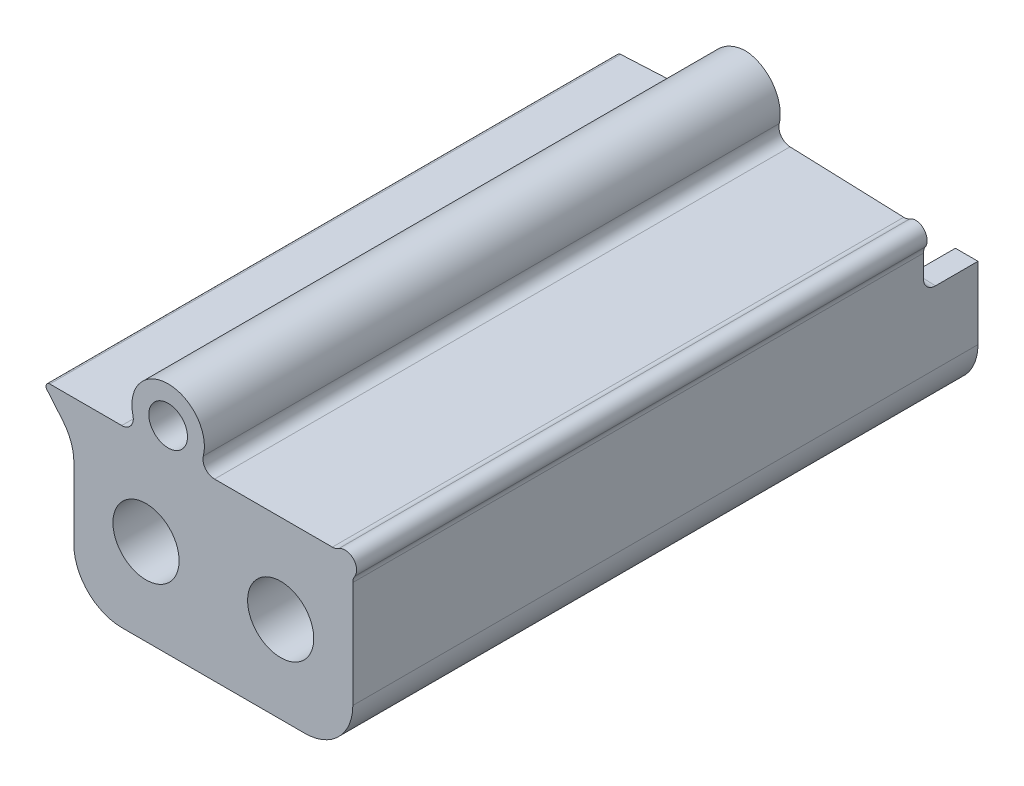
SolidWorks part; units mm, degrees
other "<24051_Punch[Mounted in the strip]>-<Cut-Extrude2>"
ref_plane "Front" through (0, 0, 0) normal (0, 0, 1) x (1, 0, 0)
ref_plane "Top" through (0, 0, 0) normal (0, 1, 0) x (1, 0, 0)
ref_plane "Right" through (0, 0, 0) normal (1, 0, 0) x (0, 0, -1)
inserted part "24051_Punch[Mounted in the strip]1"
hole_wizard "Hole1" positions "Point_Sketch" profile "Profil_Sketch" counterbore size "1/4" standard "ANSI Inch"
sketch "Point_Sketch" plane through (-72.3479, -94.696, -10.5918) normal (0, 0, 1) x (-1, 0, 0)
  point P0 (12.2341, -1.605)
  point P2 (-5.5459, -1.605)
sketch "Profil_Sketch" plane through (-84.582, -93.091, -10.5918) normal (1, 0, 0) x (0, 1, 0)
  line L0 (0, 0) -> (0, 82.55)
  line L1 (0, 82.55) -> (4.3688, 82.55)
  line L3 (4.3688, 82.55) -> (4.3688, 26.924)
  line L4 (4.3688, 26.924) -> (6.5405, 26.924)
  line L5 (6.5405, 26.924) -> (6.5405, 0)
  line L7 (6.5405, 0) -> (0, 0)
  line L11 (0, -6.35) -> (0, 107.95) construction
  dimension "Diameter" = 8.7376
  dimension "Thru Hole Depth" = 82.55
  dimension "L1" = 26.924
other "usin_LS160_.3125-18x3.25-SHCS<1>"
hole_wizard "Hole11" positions "Point_Sketch1" profile "Profil_Sketch1" legacy
sketch "Point_Sketch1" plane through (-94.5301, -77.424, 71.9582) normal (0, 0, -1) x (1, 0, 0)
  point P0 (12.8691, 0.935)
sketch "Profil_Sketch1" plane through (-81.661, -78.359, 71.9582) normal (1, 0, 0) x (0, -1, 0)
  line L0 (0, 0) -> (0, 83.2749)
  line L1 (0, 83.2749) -> (1.2065, 82.55)
  line L2 (1.2065, 82.55) -> (1.2065, 41.275)
  line L3 (1.2065, 41.275) -> (2.5527, 41.275)
  line L4 (2.5527, 0) -> (0, 0)
  line L5 (0, -11.3109) -> (0, 121.1557) construction
  line L6 (0, 83.2749) -> (-1.2065, 82.55) construction
  line L7 (2.5527, 41.275) -> (2.5527, 0)
  dimension "Depth" = 82.55
  dimension "Drill Angle" = 118
  dimension "Diameter" = 2.413
  dimension "L1" = 41.275
other "usin_TR460<1>"
other "DeleteFace1"
sketch "Sketch5" plane through (0, 0, -10.5918) normal (0, 0, -1) x (-1, 0, 0)
  line L0 (79.7841, -88.646) -> (71.5999, -88.646) construction
  line L1 (91.1225, -93.091) -> (78.0415, -93.091)
  line L2 (91.1225, -93.091) -> (91.1225, -88.646)
  line L3 (91.1225, -88.646) -> (78.0415, -88.646)
  line L4 (78.0415, -93.091) -> (78.0415, -88.646)
  line L5 (62.0041, -88.646) -> (57.277, -88.646) construction
  line L6 (73.3425, -93.091) -> (60.2615, -93.091)
  line L7 (73.3425, -93.091) -> (73.3425, -88.646)
  line L8 (73.3425, -88.646) -> (60.2615, -88.646)
  line L9 (60.2615, -93.091) -> (60.2615, -88.646)
  arc A0 (79.7841, -88.646) -> (89.3799, -88.646) centre (84.582, -93.091) ccw construction
  arc A1 (62.0041, -88.646) -> (71.5999, -88.646) centre (66.802, -93.091) ccw construction
extrude "Cut-Extrude1" cut sketch "Sketch5" against normal up to surface (6.35 mm away)
sketch "Sketch6" plane through (0, -88.646, 0) normal (0, 1, 0) x (1, 0, 0)
  line L0 (-76.8731, 4.2418) -> (-86.4489, 4.2418) construction
  line L1 (-76.8731, 4.2418) -> (-86.4489, 4.2418) construction
  line L2 (-87.757, -71.9582) -> (-94.107, -71.9582)
  line L3 (-87.757, -71.9582) -> (-94.107, -71.9582) construction
  line L4 (-94.107, -71.9582) -> (-95.5926, -71.9582)
  line L5 (-94.107, -71.9582) -> (-95.5926, -71.9582) construction
  line L6 (-95.5926, -71.9582) -> (-97.6712, -71.9582)
  line L7 (-95.5926, -71.9582) -> (-97.6712, -71.9582) construction
  line L8 (-97.6712, -71.9582) -> (-97.79, -71.9582)
  line L9 (-97.6712, -71.9582) -> (-97.79, -71.9582) construction
  line L10 (-97.79, -71.9582) -> (-97.79, 4.2418)
  line L11 (-97.79, 3.3965) -> (-97.79, 4.2418)
  line L12 (-97.79, 4.2418) -> (-97.6712, 4.2418)
  line L13 (-97.79, 4.2418) -> (-97.6712, 4.2418) construction
  line L14 (-97.6712, 4.2418) -> (-95.5926, 4.2418)
  line L15 (-97.79, 4.2418) -> (-56.769, 4.2418)
  line L16 (-95.5926, 4.2418) -> (-94.1089, 4.2418)
  line L17 (-95.5926, 4.2418) -> (-94.1089, 4.2418) construction
  line L18 (-94.1089, 4.2418) -> (-94.1089, 10.5918)
  line L19 (-94.1089, 4.2418) -> (-94.1089, 10.5918) construction
  line L22 (-94.1089, 10.5918) -> (-91.9571, 10.5918)
  line L23 (-94.1089, 10.5918) -> (-91.9571, 10.5918) construction
  line L24 (-91.9571, 10.5918) -> (-59.4269, 10.5918)
  line L25 (-91.9571, 10.5918) -> (-59.4269, 10.5918) construction
  line L26 (-59.4269, 10.5918) -> (-57.277, 10.5918)
  line L27 (-59.4269, 10.5918) -> (-57.277, 10.5918) construction
  line L28 (-57.277, 10.5918) -> (-57.277, 4.2418)
  line L29 (-57.277, 10.5918) -> (-57.277, 4.2418) construction
  line L30 (-57.277, 4.2418) -> (-57.023, 4.2418)
  line L31 (-57.277, 4.2418) -> (-57.023, 4.2418) construction
  line L32 (-57.023, 4.2418) -> (-56.769, 4.2418)
  line L33 (-57.023, 4.2418) -> (-56.769, 4.2418) construction
  line L34 (-56.769, 4.2418) -> (-56.769, -71.9582)
  line L35 (-56.769, 4.2418) -> (-56.769, 3.3726)
  line L36 (-56.769, -71.9582) -> (-57.023, -71.9582)
  line L37 (-56.769, -71.9582) -> (-57.023, -71.9582) construction
  line L38 (-57.023, -71.9582) -> (-57.277, -71.9582)
  line L39 (-57.023, -71.9582) -> (-57.277, -71.9582) construction
  line L40 (-57.277, -71.9582) -> (-63.627, -71.9582)
  line L41 (-57.277, -71.9582) -> (-63.627, -71.9582) construction
  line L42 (-63.627, -71.9582) -> (-87.757, -71.9582)
  line L43 (-63.627, -71.9582) -> (-87.757, -71.9582) construction
  line L44 (-81.6831, 4.2406) -> (-97.79, 3.3965)
  line L45 (-81.6388, 4.241) -> (-56.769, 3.3726)
  arc A0 (-81.6831, 4.2406) -> (-81.6388, 4.241) centre (-81.6566, 3.7333) cw
  point P28 (-81.661, 4.2418)
  dimension "D1" = 0.508
  dimension "D2" = 0.8453
  dimension "D3" = 3
  dimension "D4" = 0.8692
  dimension "D5" = 2
extrude "Cut-Extrude2" cut sketch "Sketch6" along normal through all
fillet "Fillet1" radius 0.508 4 edges at (-78.0415, -90.8685, -4.2418) (-91.1225, -90.8685, -4.2418) (-60.2615, -90.8685, -4.2418) (-73.3425, -90.8685, -4.2418)
fillet "Fillet2" radius 1.5875 3 edges at (-59.6405, -88.646, -3.4728) (-75.692, -88.646, -4.0334) (-91.7444, -88.646, -3.7134)
